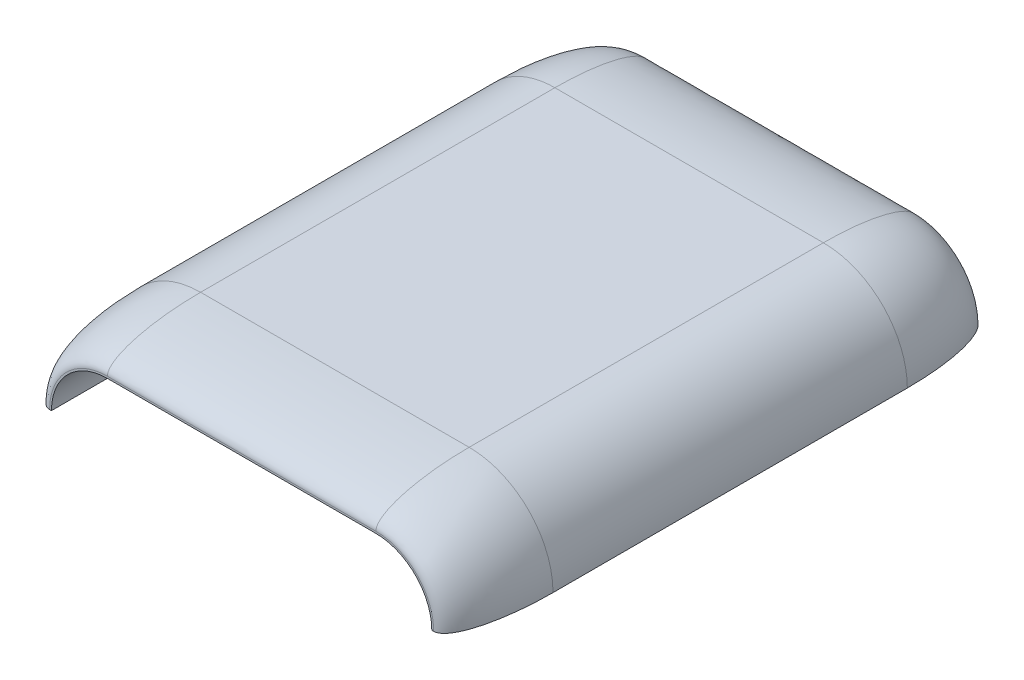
SolidWorks part; units mm, degrees
ref_plane "Спереди" through (0, 0, 0) normal (0, 0, 1) x (1, 0, 0)
ref_plane "Сверху" through (0, 0, 0) normal (0, 1, 0) x (1, 0, 0)
ref_plane "Сбоку" through (0, 0, 0) normal (1, 0, 0) x (0, 0, -1)
sketch "Эскиз1" plane through (0, 0, 0) normal (0, 0, 1) x (1, 0, 0)
  line L6 (-11.7, 0) -> (-10.2, 0)
  line L7 (10.2, 0) -> (11.7, 0)
  line L8 (0, 0) -> (0, 13.2712) construction
  line L9 (0, 0) -> (17.2362, 0) construction
  line L10 (-7.2, 3) -> (7.2, 3)
  line L11 (-7.2, 4.5) -> (7.2, 4.5)
  arc A0 (10.2, 0) -> (7.2, 3) centre (7.2, 0) ccw
  arc A1 (-7.2, 3) -> (-10.2, 0) centre (-7.2, 0) ccw
  arc A2 (11.7, 0) -> (7.2, 4.5) centre (7.2, 0) ccw
  arc A3 (-7.2, 4.5) -> (-11.7, 0) centre (-7.2, 0) ccw
  dimension "D3" = 4.5
  dimension "D4" = 3
  dimension "D1" = 23.4
  dimension "D2" = 1.5
  dimension "D5" = 4.5
extrude "Бобышка-Вытянуть1" add sketch "Эскиз1" along normal mid plane 29
fillet "Скругление1" radius 5 3 edges at (10.382, 3.182, 14.5) (-10.382, 3.182, 14.5) (0, 4.5, 14.5)
sketch "Эскиз2" plane through (0, 3, 0) normal (0, -1, 0) x (1, 0, 0)
  line L0 (0, 14.5) -> (0, -14.5) construction
  line L1 (-7.2, 14.5) -> (7.2, 14.5) construction
  line L2 (-7.2, -14.5) -> (7.2, -14.5) construction
  line L3 (0, 0) -> (13.8076, 0) construction
  circle A0 centre (0, 7.5) radius 2.4
  circle A1 centre (0, -7.5) radius 2.4
  dimension "D2" = 4.8
  dimension "D1" = 15
extrude "Бобышка-Вытянуть2" add sketch "Эскиз2" along normal blind 1.5
chamfer "Фаска1" distance 0.3 angle 45 2 edges at (0, 1.5, -5.1) (0, 1.5, 5.1)
fillet "Скругление2" radius 1.4 3 edges at (10.382, 3.182, -14.5) (-10.382, 3.182, -14.5) (0, 4.5, -14.5)
